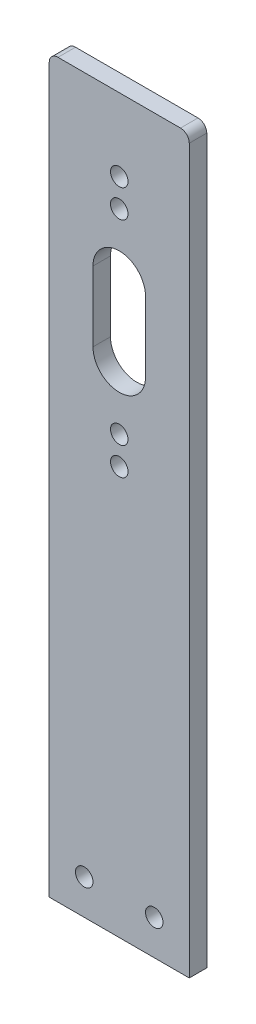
SolidWorks part; units mm, degrees
ref_plane "Front Plane" through (0, 0, 0) normal (0, 0, 1) x (1, 0, 0)
ref_plane "Top Plane" through (0, 0, 0) normal (0, 1, 0) x (1, 0, 0)
ref_plane "Right Plane" through (0, 0, 0) normal (1, 0, 0) x (0, 0, -1)
sketch "Sketch1" plane through (0, 0, 0) normal (0, 0, 1) x (1, 0, 0)
  line L0 (-25.4, -132.715) -> (25.4, -132.715)
  line L1 (-25.4, -132.715) -> (-25.4, 132.715)
  line L2 (-25.4, 132.715) -> (25.4, 132.715)
  line L3 (25.4, -132.715) -> (25.4, 132.715)
  line L4 (0, 0) -> (25.4, 0) construction
  line L5 (0, 0) -> (0, 132.715) construction
  line L6 (9.525, 73.4987) -> (9.525, 48.0987)
  line L7 (-9.525, 48.0987) -> (-9.525, 73.4987)
  line L8 (9.525, 60.7987) -> (0, 60.7987) construction
  circle A0 centre (0, 106.3574) radius 3.175
  circle A1 centre (0, 96.1974) radius 3.175
  circle A2 centre (0, 15.24) radius 3.175
  circle A3 centre (0, 25.4) radius 3.175
  circle A4 centre (12.7, -120.015) radius 3.175
  circle A5 centre (-12.7, -120.015) radius 3.175
  arc A6 (-9.525, 48.0987) -> (9.525, 48.0987) centre (0, 48.0987) ccw
  arc A7 (9.525, 73.4987) -> (-9.525, 73.4987) centre (0, 73.4987) ccw
  point P25 (0, 60.7987)
  dimension "D3" = 6.35
  dimension "D4" = 6.35
  dimension "D5" = 6.35
  dimension "D8" = 9.525
  dimension "D1" = 50.8
  dimension "D2" = 265.43
  dimension "D6" = 70.7974
  dimension "D7" = 10.16
  dimension "D9" = 25.4
  dimension "D10" = 15.24
  dimension "D12" = 10.16
  dimension "D13" = 12.7
  dimension "D14" = 25.4
extrude "Extrude1" add sketch "Sketch1" along normal mid plane 6.35
fillet "Fillet1" radius 3.175 2 edges at (25.4, 132.715, 0) (-25.4, 132.715, 0)
ref_plane "Plane1" through (0, 60.7987, 0) normal (0, 1, 0) x (-1, 0, 0)
